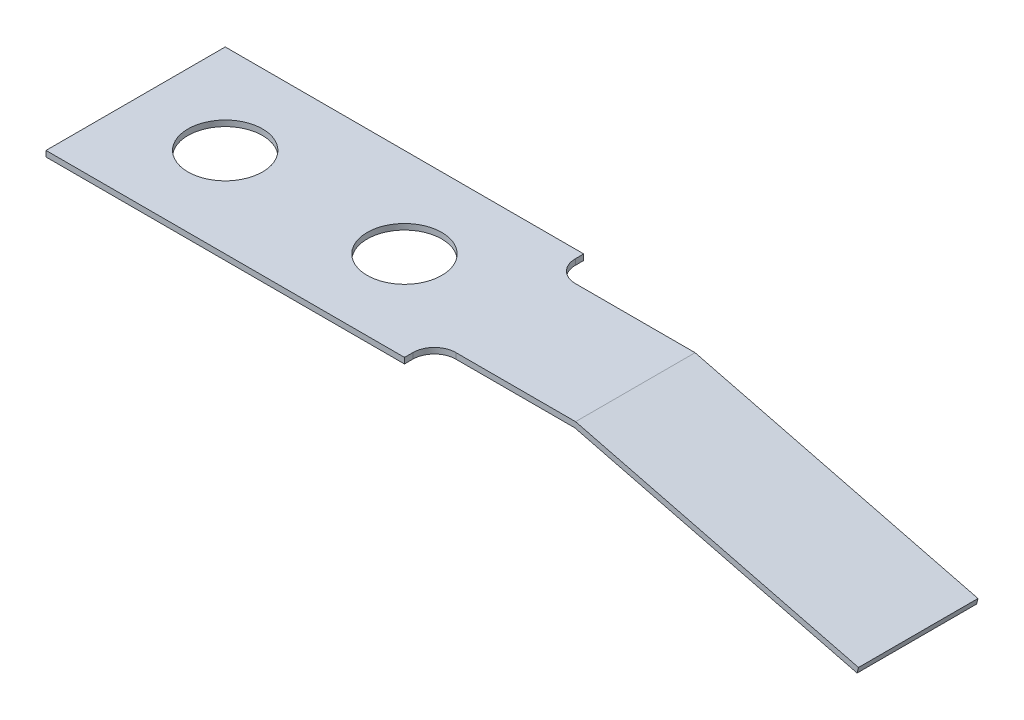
SolidWorks part; units mm, degrees
ref_plane "Front Plane" through (0, 0, 0) normal (0, 0, 1) x (1, 0, 0)
ref_plane "Top Plane" through (0, 0, 0) normal (0, 1, 0) x (1, 0, 0)
ref_plane "Right Plane" through (0, 0, 0) normal (1, 0, 0) x (0, 0, -1)
sketch "Sketch1" plane through (0, 0, 0) normal (0, 1, 0) x (1, 0, 0)
  line L0 (0, 0) -> (0, 14.9391) construction
  line L1 (-9.525, -4.7625) -> (9.525, -4.7625)
  line L2 (-9.525, -4.7625) -> (-9.525, 4.7625)
  line L3 (-9.525, 4.7625) -> (9.525, 4.7625)
  line L4 (9.525, -4.7625) -> (9.525, 4.7625)
  line L5 (-9.525, -4.7625) -> (9.525, 4.7625) construction
  line L6 (-9.525, 4.7625) -> (9.525, -4.7625) construction
  line L7 (0, 0) -> (-34.5199, 0) construction
  circle A0 centre (-4.7625, 0) radius 1.9812
  circle A1 centre (4.7625, 0) radius 1.9812
  point P0 (0, 0)
  dimension "D3" = 3.9624
  dimension "D4" = 9.525
  dimension "D1" = 9.525
  dimension "D2" = 19.05
extrude "Boss-Extrude1" add sketch "Sketch1" along normal blind 0.3048
sketch "Sketch2" plane through (0, 0.3048, 0) normal (0, 1, 0) x (1, 0, 0)
  line L0 (-9.525, -4.7625) -> (-18.9324, -4.7625)
  line L1 (-19.0965, -0.7239) -> (-10.9837, -0.0635)
  line L2 (-9.525, 4.7625) -> (-9.525, -4.7625) construction
  line L3 (-9.525, 1.5188) -> (-9.525, -4.7625)
  arc A0 (-18.9324, -4.7625) -> (-19.0965, -0.7239) centre (-18.9324, -2.7399) cw
  arc A1 (-10.9837, -0.0635) -> (-9.525, 1.5188) centre (-11.1125, 1.5188) ccw
  dimension "D4" = 1.5875
  dimension "D1" = 11.43
  dimension "D2" = 4.0386
  dimension "D3" = 4.699
extrude "Boss-Extrude2" [suppressed] add sketch "Sketch2" against normal blind 0.2032
sketch "Sketch3" [suppressed] plane through (0, 0.2032, 0) normal (0, 1, 0) x (1, 0, 0)
  circle A0 centre (-18.9324, -2.7399) radius 1.016
  dimension "D1" = 2.032
extrude "Cut-Extrude1" [suppressed] cut sketch "Sketch3" against normal through all
sketch "Sketch4" plane through (0, 0.3048, 0) normal (0, 1, 0) x (1, 0, 0)
  line L1 (9.525, 3.175) -> (16.9926, 3.175)
  line L2 (9.525, 3.175) -> (9.525, -3.175)
  line L3 (9.525, -3.175) -> (16.9926, -3.175)
  line L4 (16.9926, 3.175) -> (16.9926, -3.175)
  line L5 (9.525, -4.7625) -> (9.525, 4.7625) construction
  line L6 (-9.525, -4.7625) -> (9.525, -4.7625) construction
  line L7 (9.525, 4.7625) -> (-9.525, 4.7625) construction
  dimension "D1" = 7.4676
  dimension "D2" = 1.5875
  dimension "D3" = 1.5875
extrude "Boss-Extrude3" add sketch "Sketch4" against normal blind 0.3048
fillet "Fillet1" radius 1.143 2 edges
sketch "Sketch5" plane through (0, 0, -3.175) normal (0, 0, -1) x (-1, 0, 0)
  line L0 (-16.9926, 0) -> (-31.9911, -3.7846)
  line L1 (-17.0305, 0.3048) -> (-32.0657, -3.4891)
  line L2 (-32.0657, -3.4891) -> (-31.9911, -3.7846)
  line L3 (-16.9926, 0) -> (-10.668, 0) construction
  line L4 (-16.9926, 0.3048) -> (-17.0305, 0.3048)
  line L5 (-16.9926, 0.3048) -> (-16.9926, 0)
  line L6 (-17.0672, 0.2955) -> (-32.0657, -3.4891) construction
  dimension "D2" = 15.4686
  dimension "D3" = 3.7846
  dimension "D1" = 0.3048
extrude "Boss-Extrude4" add sketch "Sketch5" against normal up to surface (6.35 mm away)
